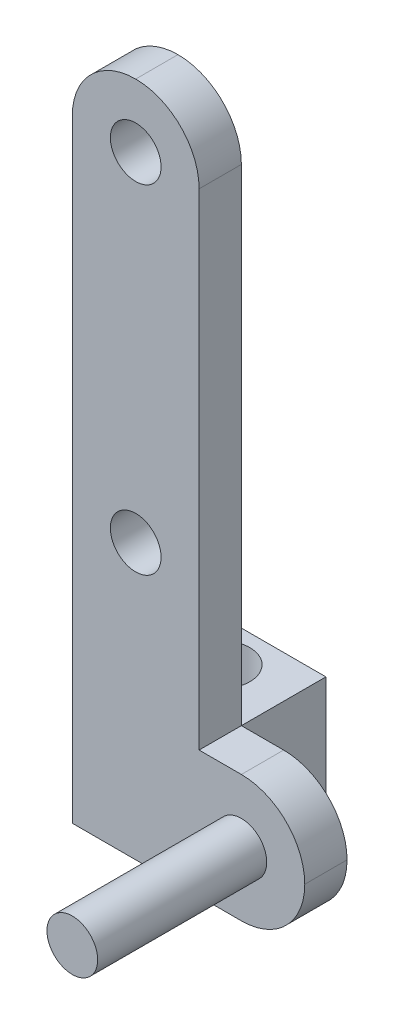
SolidWorks part; units mm, degrees
ref_plane "Plan de face" through (0, 0, 0) normal (0, 0, 1) x (1, 0, 0)
ref_plane "Plan de dessus" through (0, 0, 0) normal (0, 1, 0) x (1, 0, 0)
ref_plane "Plan de droite" through (0, 0, 0) normal (1, 0, 0) x (0, 0, -1)
sketch "Esquisse1" plane through (0, 0, 0) normal (0, 0, 1) x (1, 0, 0)
  line L0 (25, -160) -> (-30, -160)
  line L1 (0, 0) -> (0, -130)
  line L2 (0, 0) -> (-30, 0)
  line L3 (-30, 0) -> (-30, -160)
  line L4 (0, -130) -> (25, -130)
  line L5 (25, -160) -> (25, -130)
  dimension "D5" = 25
  dimension "D1" = 160
  dimension "D2" = 130
  dimension "D3" = 55
  dimension "D4" = 30
extrude "Extrusion1" add sketch "Esquisse1" along normal blind 10
sketch "Esquisse2" plane through (0, 0, 10) normal (0, 0, 1) x (1, 0, 0)
  circle A0 centre (10, -145) radius 6
  dimension "D1" = 12
  dimension "D3" = 15
  dimension "D2" = 15
extrude "Extrusion2" add sketch "Esquisse2" along normal blind 40
sketch "Esquisse3" plane through (0, 0, 0) normal (0, 0, -1) x (-1, 0, 0)
  line L0 (0, -130) -> (0, -160)
  line L1 (-25, -130) -> (0, -130) construction
  line L2 (0, -130) -> (0, 0) construction
  line L3 (30, -160) -> (-25, -160) construction
  line L4 (0, -160) -> (30, -160)
  line L5 (30, -160) -> (30, -130)
  line L6 (30, 0) -> (30, -160) construction
  line L7 (30, -130) -> (0, -130)
extrude "Extrusion3" add sketch "Esquisse3" along normal blind 20
sketch "Esquisse5" plane through (0, 0, 10) normal (0, 0, 1) x (1, 0, 0)
  line L2 (0, -130) -> (0, 0) construction
  circle A0 centre (-15, -15) radius 6
  circle A1 centre (-15, -95) radius 6
  dimension "D1" = 12
  dimension "D2" = 15
  dimension "D3" = 15
  dimension "D4" = 80
  dimension "D5" = 15
extrude "Enlèv. mat.-Extru.2" cut sketch "Esquisse5" against normal through all
fillet "Congé1" radius 15 4 edges at (25, -160, 5) (25, -130, 5) (-30, 0, 5) (0, 0, 5)
hole_wizard "Trou taraudé M161" positions "Esquisse7" profile "Esquisse6" tap size "M16" standard "ISO"
sketch "Esquisse7" plane through (0, -130, 0) normal (0, 1, 0) x (-1, 0, 0)
  line L0 (30, 10) -> (15, 10) construction
  line L1 (0, -20) -> (0, 0) construction
  point P0 (15, -10)
  point P4 (0, -10)
  dimension "D1" = 20
  dimension "D2" = 15
sketch "Esquisse6" plane through (-15, -130, -10) normal (1, 0, 0) x (0, 0, 1)
  line L0 (0, 0) -> (0, 30.0001)
  line L1 (0, 30.0001) -> (7, 30.0001)
  line L2 (7, 30.0001) -> (7, 0)
  line L5 (7, 0) -> (0, 0)
  line L11 (0, -6.35) -> (0, 107.95) construction
  dimension "Diamètre du trou pour taraudage jusqu'au prochain" = 14
  dimension "Profondeur du trou pour taraudage jusqu'au prochain" = 30.0001
